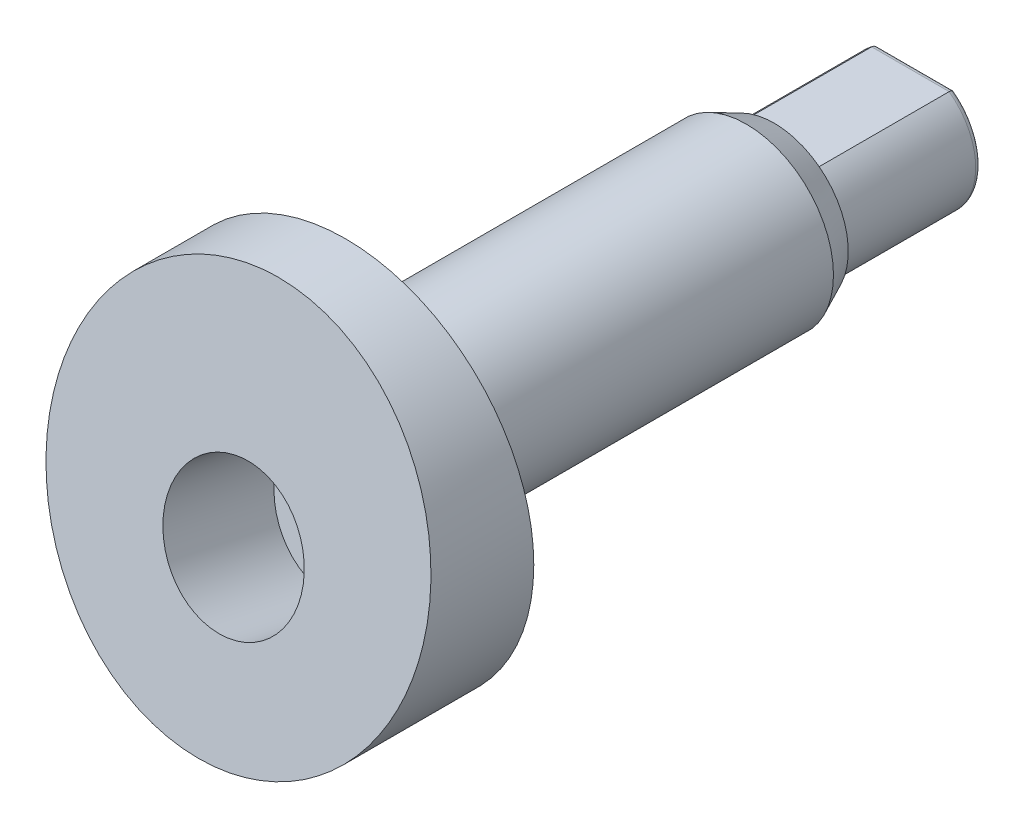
SolidWorks part; units mm, degrees
ref_plane "Plane1" through (0, 0, 0) normal (0, 0, 1) x (1, 0, 0)
ref_plane "Plane2" through (0, 0, 0) normal (0, 1, 0) x (1, 0, 0)
ref_plane "Plane3" through (0, 0, 0) normal (1, 0, 0) x (0, 0, -1)
sketch "Sketch1" plane through (0, 0, 0) normal (0, 0, 1) x (1, 0, 0)
  line L0 (13.1575, 0) -> (-10.5307, 0) construction
  line L1 (0, 12.7794) -> (0, -10.5661) construction
  circle A0 centre (0, 0) radius 8.636
  dimension "D1" = 17.272
extrude "swash_base" add sketch "Sketch1" along normal blind 6.7437
sketch "Sketch2" plane through (0, 0, 0) normal (1, 0, 0) x (0, 0, -1)
  line L0 (-6.7437, -8.636) -> (-6.7437, 8.636)
  line L1 (-6.7437, 8.636) -> (-3.0724, 8.636)
  line L3 (-3.0724, 8.636) -> (-6.7437, -8.636)
  line L4 (-6.7437, 8.636) -> (-6.7437, -8.636) construction
  dimension "D2" = 17.272
extrude "swash_angle_cut" cut sketch "Sketch2" against normal mid plane 25.6588
sketch "Sketch4" plane through (0, 0, 0) normal (0, 0, -1) x (-1, 0, 0)
  circle A0 centre (0, 0) radius 3.9903
extrude "motor_shaft" add sketch "Sketch4" along normal blind 26.162
sketch "Sketch5" plane through (0, 0, -26.162) normal (0, 0, -1) x (-1, 0, 0)
  line L1 (0, 2.413) -> (1.7778, 2.413)
  line L2 (0, 2.413) -> (-1.7778, 2.413)
  arc A0 (-1.7778, 2.413) -> (1.7778, 2.413) centre (0, 0) ccw
extrude "D_cut" cut sketch "Sketch5" against normal blind 6.5024 flip side to cut
fillet "Fillet4" radius 0.254 2 edges at (0, 2.413, -26.162) (0, -2.9972, -26.162)
chamfer "Chamfer1" distance 1.27 angle 25 1 edges at (-3.9903, 0, -19.6596)
sketch "Sketch9" plane through (0, 0.9981, 4.6959) normal (0, 0.2079, 0.9781) x (1, 0, 0)
  circle A0 centre (0, -2.0999) radius 3.175
extrude "Cut-Extrude2" cut sketch "Sketch9" against normal blind 5.207
ref_plane "Plane4" through (0, 0.9981, 4.6959) normal (0, 0.2079, 0.9781) x (1, 0, 0)
sketch "Sketch11" plane through (0, 0.9981, 4.6959) normal (0, 0.2079, 0.9781) x (1, 0, 0)
  line L1 (0, -1.0204) -> (0, -2.0999)
  dimension "D1" = 1.0795
sketch "Sketch14" plane through (0, 0, 0) normal (1, 0, 0) x (0, 0, -1)
  line L0 (18.3896, 0) -> (-6.8475, 0) construction
  line L3 (18.3896, -3.9903) -> (18.3896, 3.9903) construction
  line L4 (0, 4.2443) -> (0, 3.9903)
  line L5 (0.254, 3.9903) -> (0, 3.9903)
  arc A0 (0, 4.2443) -> (0.254, 3.9903) centre (0.254, 4.2443) ccw
revolve "Revolve2" add sketch "Sketch14" angle 360 about L0
